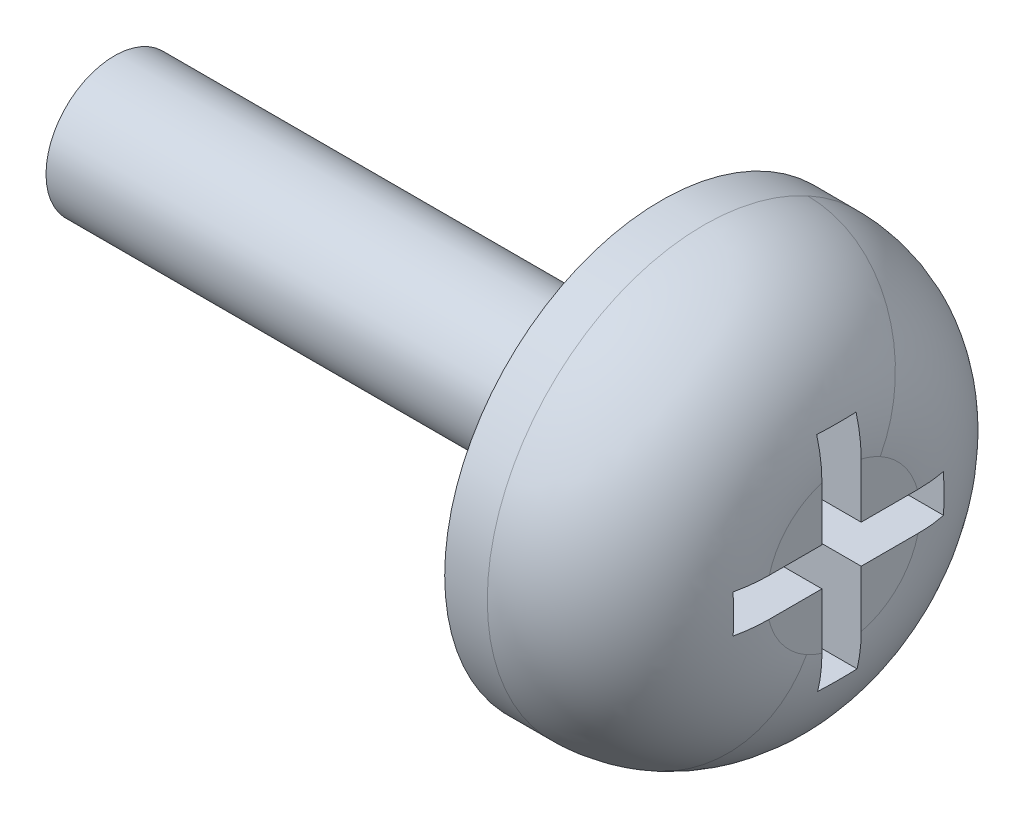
SolidWorks part; units mm, degrees
ref_plane "Plan de face" through (0, 0, 0) normal (0, 0, 1) x (1, 0, 0)
ref_plane "Plan de dessus" through (0, 0, 0) normal (0, 1, 0) x (1, 0, 0)
ref_plane "Plan de droite" through (0, 0, 0) normal (1, 0, 0) x (0, 0, -1)
imported_body "Importée1"
sketch "Esquisse1" plane through (0, 0, 0) normal (-1, 0, 0) x (0, 0, 1)
  circle A0 centre (0, 0) radius 1.5
  circle A1 centre (0, 0) radius 2.5 construction
  circle A2 centre (0, 0) radius 2.5
  dimension "D1" = 3
extrude "Enlèv. mat.-Extru.1" cut sketch "Esquisse1" against normal up to surface (12 mm away)
